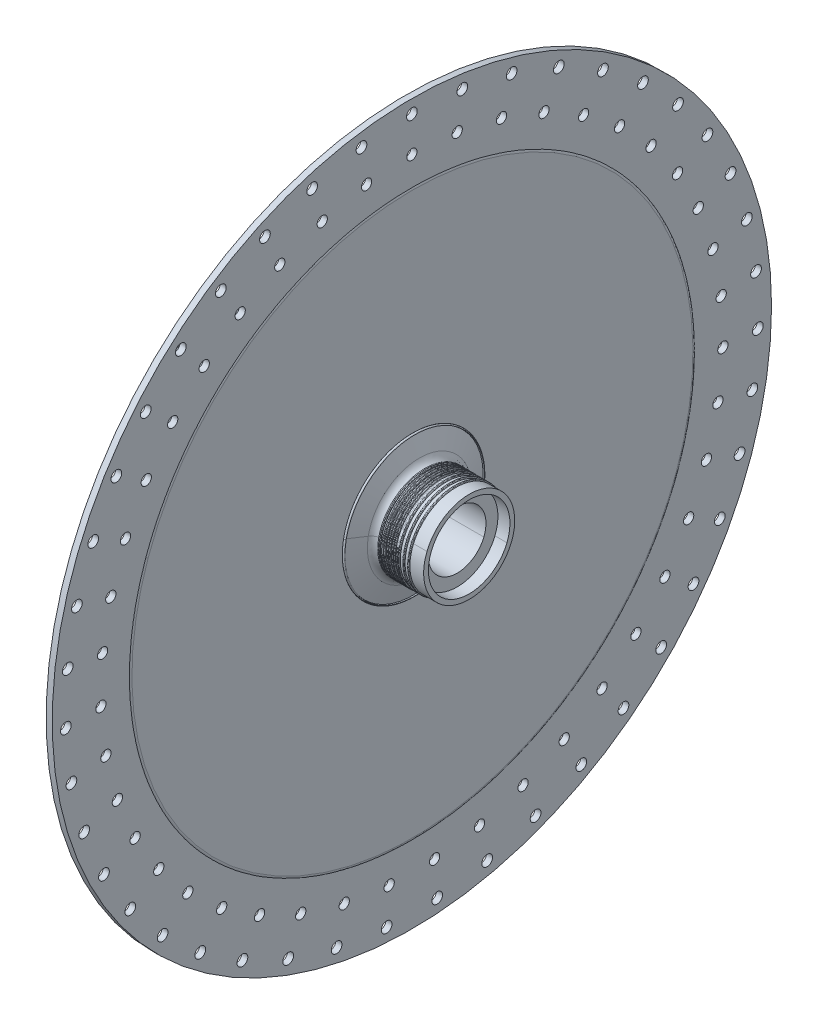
SolidWorks part; units mm, degrees
ref_plane "Alzado" through (0, 0, 0) normal (0, 0, 1) x (1, 0, 0)
ref_plane "Planta" through (0, 0, 0) normal (0, 1, 0) x (1, 0, 0)
ref_plane "Vista lateral" through (0, 0, 0) normal (1, 0, 0) x (0, 0, -1)
imported_body "A1223.IGS<1>"
delete or keep bodies "Sólido-Eliminar/Conservar 1" type delete bodies bodies 106
ref_plane "Plano1" through (70, 0, 0) normal (1, 0, 0) x (0, 0, -1)
sketch "Croquis2" plane through (70, 0, 0) normal (1, 0, 0) x (0, 0, -1)
  circle A0 centre (13.6251, -11.4202) radius 149.987
  dimension "D1" = 299.974
extrude "Saliente-Extruir1" add sketch "Croquis2" against normal blind 2.54
sketch "Croquis3" plane through (70, 0, 0) normal (1, 0, 0) x (0, 0, -1)
  line L0 (13.6251, 132.961) -> (13.6251, 17.5798) construction
  circle A0 centre (13.6251, 132.961) radius 2.235
  arc A1 (42.0967, -16.9313) -> (-14.8464, -5.9092) centre (13.6251, -11.4202) ccw construction
  circle A2 centre (13.6251, 23.0117) radius 1.976
  circle A4 centre (13.6251, 103.5224) radius 2.1431
  circle A5 centre (13.6251, 46.5259) radius 2.2316
  circle A6 centre (13.6251, 59.8166) radius 2.2894
  circle A8 centre (13.6251, 118.3465) radius 2.1431
  circle A9 centre (13.6251, 34.5133) radius 1.9924
  circle A10 centre (13.6251, 75.2704) radius 1.9807
  circle A11 centre (13.6251, 88.6982) radius 2.1195
  circle A12 centre (13.6251, -11.4202) radius 12 construction
  circle A13 centre (30.3609, 102.2975) radius 2.1431
  circle A14 centre (22.0622, 45.9084) radius 2.2316
  circle A15 centre (23.9973, 59.0574) radius 2.2894
  circle A16 centre (32.5193, 116.9637) radius 2.1431
  circle A17 centre (20.3131, 34.0238) radius 1.9924
  circle A18 centre (26.2474, 74.3466) radius 1.9807
  circle A19 centre (28.2025, 87.6312) radius 2.1195
  circle A20 centre (34.6472, 131.4224) radius 2.235
  circle A21 centre (46.74, 98.6489) radius 2.1431
  circle A22 centre (30.3194, 44.0691) radius 2.2316
  circle A23 centre (34.1484, 56.7962) radius 2.2894
  circle A24 centre (51.0108, 112.8445) radius 2.1431
  circle A25 centre (26.8585, 32.5657) radius 1.9924
  circle A26 centre (38.6006, 71.5948) radius 1.9807
  circle A27 centre (42.4692, 84.4532) radius 2.1195
  circle A28 centre (55.2212, 126.8393) radius 2.235
  circle A29 centre (62.4133, 92.6543) radius 2.1431
  circle A30 centre (38.2208, 41.047) radius 2.2316
  circle A31 centre (43.8621, 53.081) radius 2.2894
  circle A32 centre (68.7055, 106.0769) radius 2.1431
  circle A33 centre (33.1219, 30.1702) radius 1.9924
  circle A34 centre (50.4215, 67.0736) radius 1.9807
  circle A35 centre (56.1211, 79.2318) radius 2.1195
  circle A36 centre (74.9087, 119.3095) radius 2.235
  circle A37 centre (77.0467, 84.4416) radius 2.1431
  circle A38 centre (45.598, 36.9068) radius 2.2316
  circle A39 centre (52.9313, 47.9911) radius 2.2894
  circle A40 centre (85.2262, 96.805) radius 2.1431
  circle A41 centre (38.9698, 26.8882) radius 1.9924
  circle A42 centre (61.4582, 60.8796) radius 1.9807
  circle A43 centre (68.8672, 72.0783) radius 2.1195
  circle A44 centre (93.2901, 108.9934) radius 2.235
  circle A45 centre (90.3285, 74.1858) radius 2.1431
  circle A46 centre (52.2937, 31.7365) radius 2.2316
  circle A47 centre (61.1628, 41.635) radius 2.2894
  circle A48 centre (100.2209, 85.2264) radius 2.1431
  circle A49 centre (44.2774, 22.7897) radius 1.9924
  circle A50 centre (71.4754, 53.1445) radius 1.9807
  circle A51 centre (80.436, 63.1452) radius 2.1195
  circle A52 centre (109.9735, 96.1109) radius 2.235
  circle A53 centre (101.9754, 62.1054) radius 2.1431
  circle A54 centre (58.1653, 25.6464) radius 2.2316
  circle A55 centre (68.3811, 34.148) radius 2.2894
  circle A56 centre (113.37, 71.5881) radius 2.1431
  circle A57 centre (48.9318, 17.9622) radius 1.9924
  circle A58 centre (80.2596, 44.0334) radius 1.9807
  circle A59 centre (90.5809, 52.6228) radius 2.1195
  circle A60 centre (124.6034, 80.9366) radius 2.235
  circle A61 centre (111.7393, 48.458) radius 2.1431
  circle A62 centre (63.0876, 18.7663) radius 2.2316
  circle A63 centre (74.4324, 25.6899) radius 2.2894
  circle A64 centre (124.3932, 56.1805) radius 2.1431
  circle A65 centre (52.8336, 12.5084) radius 1.9924
  circle A66 centre (87.6237, 33.7404) radius 1.9807
  circle A67 centre (99.0855, 40.7355) radius 2.1195
  circle A68 centre (136.868, 63.7938) radius 2.235
  circle A69 centre (119.4121, 33.5343) radius 2.1431
  circle A70 centre (66.9557, 11.2428) radius 2.2316
  circle A71 centre (79.1877, 16.4408) radius 2.2894
  circle A72 centre (133.0555, 39.3322) radius 2.1431
  circle A73 centre (55.8998, 6.5446) radius 1.9924
  circle A74 centre (93.4105, 22.4849) radius 1.9807
  circle A75 centre (105.7687, 27.7365) radius 2.1195
  circle A76 centre (146.5059, 45.0479) radius 2.235
  circle A77 centre (124.8302, 17.6526) radius 2.1431
  circle A78 centre (69.6871, 3.2363) radius 2.2316
  circle A79 centre (82.5456, 6.5979) radius 2.2894
  circle A80 centre (139.1724, 21.4021) radius 2.1431
  circle A81 centre (58.065, 0.1979) radius 1.9924
  circle A82 centre (97.4969, 10.5067) radius 1.9807
  circle A83 centre (110.4881, 13.903) radius 2.1195
  circle A84 centre (153.3116, 25.0986) radius 2.235
  circle A85 centre (127.8782, 1.1512) radius 2.1431
  circle A86 centre (71.2237, -5.0826) radius 2.2316
  circle A87 centre (84.4346, -3.629) radius 2.2894
  circle A88 centre (142.6134, 2.7725) radius 2.1431
  circle A89 centre (59.2831, -6.3964) radius 1.9924
  circle A90 centre (99.7957, -1.9388) radius 1.9807
  circle A91 centre (113.1429, -0.4702) radius 2.1195
  circle A92 centre (157.1402, 4.3709) radius 2.235
  circle A93 centre (128.491, -15.6182) radius 2.1431
  circle A94 centre (71.5327, -13.5366) radius 2.2316
  circle A95 centre (84.8144, -14.022) radius 2.2894
  circle A96 centre (143.3053, -16.1596) radius 2.1431
  circle A97 centre (59.528, -13.0978) radius 1.9924
  circle A98 centre (100.2579, -14.5864) radius 1.9807
  circle A99 centre (113.6768, -15.0768) radius 2.1195
  circle A100 centre (157.9101, -16.6933) radius 2.235
  circle A101 centre (126.6557, -32.2981) radius 2.1431
  circle A102 centre (70.6074, -21.9454) radius 2.2316
  circle A103 centre (83.677, -24.3595) radius 2.2894
  circle A104 centre (141.2333, -34.9907) radius 2.1431
  circle A105 centre (58.7946, -19.7635) radius 1.9924
  circle A106 centre (98.8737, -27.1665) radius 1.9807
  circle A107 centre (112.0781, -29.6054) radius 2.1195
  circle A108 centre (155.6047, -37.6452) radius 2.235
  circle A109 centre (122.4114, -48.533) radius 2.1431
  circle A110 centre (68.4677, -30.1299) radius 2.2316
  circle A111 centre (81.0465, -34.4212) radius 2.2894
  circle A112 centre (136.4416, -53.3194) radius 2.1431
  circle A113 centre (57.0984, -26.2513) radius 1.9924
  circle A114 centre (95.6726, -39.411) radius 1.9807
  circle A115 centre (108.3812, -43.7465) radius 2.1195
  circle A116 centre (150.2733, -58.0381) radius 2.235
  circle A117 centre (115.8484, -63.9769) radius 2.1431
  circle A118 centre (65.1591, -37.9157) radius 2.2316
  circle A119 centre (76.979, -43.9927) radius 2.2894
  circle A120 centre (129.0322, -70.7551) radius 2.1431
  circle A121 centre (54.4757, -32.423) radius 1.9924
  circle A122 centre (90.7228, -51.0589) radius 1.9807
  circle A123 centre (102.6647, -57.1986) radius 2.1195
  circle A124 centre (142.0295, -77.4375) radius 2.235
  circle A125 centre (107.1068, -78.3006) radius 2.1431
  circle A126 centre (60.7522, -45.1368) radius 2.2316
  circle A127 centre (71.5613, -52.87) radius 2.2894
  circle A128 centre (119.1631, -86.9262) radius 2.1431
  circle A129 centre (50.9824, -38.1471) radius 1.9924
  circle A130 centre (84.1297, -61.862) radius 1.9807
  circle A131 centre (95.0504, -69.675) radius 2.1195
  circle A132 centre (131.0489, -95.4298) radius 2.235
  circle A133 centre (96.3727, -91.1989) radius 2.1431
  circle A134 centre (55.3408, -51.6392) radius 2.2316
  circle A135 centre (64.9088, -60.8639) radius 2.2894
  circle A136 centre (107.0447, -101.488) radius 2.1431
  circle A137 centre (46.6928, -43.3015) radius 1.9924
  circle A138 centre (76.034, -71.59) radius 1.9807
  circle A139 centre (85.7007, -80.9099) radius 2.1195
  circle A140 centre (117.5657, -111.6316) radius 2.235
  circle A141 centre (83.875, -102.3969) radius 2.1431
  circle A142 centre (49.0403, -57.2845) radius 2.2316
  circle A143 centre (57.1632, -67.804) radius 2.2894
  circle A144 centre (92.9352, -114.1302) radius 2.1431
  circle A145 centre (41.6985, -47.7764) radius 1.9924
  circle A146 centre (66.6082, -80.0356) radius 1.9807
  circle A147 centre (74.8149, -90.6636) radius 2.1195
  circle A148 centre (101.8672, -125.6975) radius 2.235
  circle A149 centre (69.8801, -111.6559) radius 2.1431
  circle A150 centre (41.985, -61.9522) radius 2.2316
  circle A151 centre (48.4897, -73.5423) radius 2.2894
  circle A152 centre (77.1353, -124.5833) radius 2.1431
  circle A153 centre (36.1058, -51.4765) radius 1.9924
  circle A154 centre (56.0531, -87.0188) radius 1.9807
  circle A155 centre (62.6249, -98.7285) radius 2.1195
  circle A156 centre (84.2879, -137.3278) radius 2.235
  circle A157 centre (54.6862, -118.7785) radius 2.1431
  circle A158 centre (34.3253, -65.5429) radius 2.2316
  circle A159 centre (39.0731, -77.9566) radius 2.2894
  circle A160 centre (59.9818, -132.6245) radius 2.1431
  circle A161 centre (30.034, -54.3229) radius 1.9924
  circle A162 centre (44.5937, -92.3907) radius 1.9807
  circle A163 centre (49.3905, -104.9325) radius 2.1195
  circle A164 centre (65.2026, -146.2747) radius 2.235
  circle A165 centre (38.6171, -123.6129) radius 2.1431
  circle A166 centre (26.2244, -67.9801) radius 2.2316
  circle A167 centre (29.1142, -80.9528) radius 2.2894
  circle A168 centre (41.8403, -138.0825) radius 2.1431
  circle A169 centre (23.6125, -56.2548) radius 1.9924
  circle A170 centre (32.4743, -96.0369) radius 1.9807
  circle A171 centre (35.3939, -109.1434) radius 2.1195
  circle A172 centre (45.018, -152.3473) radius 2.235
  circle A173 centre (22.0154, -126.0562) radius 2.1431
  circle A174 centre (17.8549, -69.2119) radius 2.2316
  circle A175 centre (18.8251, -82.467) radius 2.2894
  circle A176 centre (23.0975, -140.8408) radius 2.1431
  circle A177 centre (16.9781, -57.2312) radius 1.9924
  circle A178 centre (19.9531, -97.8796) radius 1.9807
  circle A179 centre (20.9333, -111.2716) radius 2.1195
  circle A180 centre (24.1643, -155.4163) radius 2.235
  circle A181 centre (5.2349, -126.0562) radius 2.1431
  circle A182 centre (9.3953, -69.2119) radius 2.2316
  circle A183 centre (8.4252, -82.467) radius 2.2894
  circle A184 centre (4.1528, -140.8408) radius 2.1431
  circle A185 centre (10.2722, -57.2312) radius 1.9924
  circle A186 centre (7.2971, -97.8796) radius 1.9807
  circle A187 centre (6.317, -111.2716) radius 2.1195
  circle A188 centre (3.086, -155.4163) radius 2.235
  circle A189 centre (-11.3669, -123.6129) radius 2.1431
  circle A190 centre (1.0259, -67.9801) radius 2.2316
  circle A191 centre (-1.8639, -80.9528) radius 2.2894
  circle A192 centre (-14.5901, -138.0825) radius 2.1431
  circle A193 centre (3.6378, -56.2548) radius 1.9924
  circle A194 centre (-5.224, -96.0369) radius 1.9807
  circle A195 centre (-8.1436, -109.1434) radius 2.1195
  circle A196 centre (-17.7677, -152.3473) radius 2.235
  circle A197 centre (-27.4359, -118.7785) radius 2.1431
  circle A198 centre (-7.075, -65.5429) radius 2.2316
  circle A199 centre (-11.8229, -77.9566) radius 2.2894
  circle A200 centre (-32.7316, -132.6245) radius 2.1431
  circle A201 centre (-2.7837, -54.3229) radius 1.9924
  circle A202 centre (-17.3434, -92.3907) radius 1.9807
  circle A203 centre (-22.1403, -104.9325) radius 2.1195
  circle A204 centre (-37.9523, -146.2747) radius 2.235
  circle A205 centre (-42.6298, -111.6559) radius 2.1431
  circle A206 centre (-14.7348, -61.9522) radius 2.2316
  circle A207 centre (-21.2394, -73.5423) radius 2.2894
  circle A208 centre (-49.885, -124.5833) radius 2.1431
  circle A209 centre (-8.8555, -51.4765) radius 1.9924
  circle A210 centre (-28.8028, -87.0188) radius 1.9807
  circle A211 centre (-35.3746, -98.7285) radius 2.1195
  circle A212 centre (-57.0376, -137.3278) radius 2.235
  circle A213 centre (-56.6248, -102.3969) radius 2.1431
  circle A214 centre (-21.7901, -57.2845) radius 2.2316
  circle A215 centre (-29.913, -67.804) radius 2.2894
  circle A216 centre (-65.6849, -114.1302) radius 2.1431
  circle A217 centre (-14.4482, -47.7764) radius 1.9924
  circle A218 centre (-39.3579, -80.0356) radius 1.9807
  circle A219 centre (-47.5646, -90.6636) radius 2.1195
  circle A220 centre (-74.6169, -125.6975) radius 2.235
  circle A221 centre (-69.1224, -91.1989) radius 2.1431
  circle A222 centre (-28.0905, -51.6392) radius 2.2316
  circle A223 centre (-37.6585, -60.8639) radius 2.2894
  circle A224 centre (-79.7944, -101.488) radius 2.1431
  circle A225 centre (-19.4426, -43.3015) radius 1.9924
  circle A226 centre (-48.7838, -71.59) radius 1.9807
  circle A227 centre (-58.4505, -80.9099) radius 2.1195
  circle A228 centre (-90.3154, -111.6316) radius 2.235
  circle A229 centre (-79.8565, -78.3006) radius 2.1431
  circle A230 centre (-33.5019, -45.1368) radius 2.2316
  circle A231 centre (-44.3111, -52.87) radius 2.2894
  circle A232 centre (-91.9129, -86.9262) radius 2.1431
  circle A233 centre (-23.7321, -38.1471) radius 1.9924
  circle A234 centre (-56.8795, -61.862) radius 1.9807
  circle A235 centre (-67.8002, -69.675) radius 2.1195
  circle A236 centre (-103.7987, -95.4298) radius 2.235
  circle A237 centre (-88.5982, -63.9769) radius 2.1431
  circle A238 centre (-37.9089, -37.9157) radius 2.2316
  circle A239 centre (-49.7288, -43.9927) radius 2.2894
  circle A240 centre (-101.7819, -70.7551) radius 2.1431
  circle A241 centre (-27.2255, -32.423) radius 1.9924
  circle A242 centre (-63.4725, -51.0589) radius 1.9807
  circle A243 centre (-75.4144, -57.1986) radius 2.1195
  circle A244 centre (-114.7792, -77.4375) radius 2.235
  circle A245 centre (-95.1611, -48.533) radius 2.1431
  circle A246 centre (-41.2175, -30.1299) radius 2.2316
  circle A247 centre (-53.7962, -34.4212) radius 2.2894
  circle A248 centre (-109.1913, -53.3194) radius 2.1431
  circle A249 centre (-29.8482, -26.2513) radius 1.9924
  circle A250 centre (-68.4223, -39.411) radius 1.9807
  circle A251 centre (-81.1309, -43.7465) radius 2.1195
  circle A252 centre (-123.023, -58.0381) radius 2.235
  circle A253 centre (-99.4055, -32.2981) radius 2.1431
  circle A254 centre (-43.3572, -21.9454) radius 2.2316
  circle A255 centre (-56.4267, -24.3595) radius 2.2894
  circle A256 centre (-113.9831, -34.9907) radius 2.1431
  circle A257 centre (-31.5443, -19.7635) radius 1.9924
  circle A258 centre (-71.6235, -27.1665) radius 1.9807
  circle A259 centre (-84.8279, -29.6054) radius 2.1195
  circle A260 centre (-128.3544, -37.6452) radius 2.235
  circle A261 centre (-101.2408, -15.6182) radius 2.1431
  circle A262 centre (-44.2824, -13.5366) radius 2.2316
  circle A263 centre (-57.5642, -14.022) radius 2.2894
  circle A264 centre (-116.0551, -16.1596) radius 2.1431
  circle A265 centre (-32.2777, -13.0978) radius 1.9924
  circle A266 centre (-73.0077, -14.5864) radius 1.9807
  circle A267 centre (-86.4265, -15.0768) radius 2.1195
  circle A268 centre (-130.6598, -16.6933) radius 2.235
  circle A269 centre (-100.6279, 1.1512) radius 2.1431
  circle A270 centre (-43.9734, -5.0826) radius 2.2316
  circle A271 centre (-57.1844, -3.629) radius 2.2894
  circle A272 centre (-115.3632, 2.7725) radius 2.1431
  circle A273 centre (-32.0328, -6.3964) radius 1.9924
  circle A274 centre (-72.5454, -1.9388) radius 1.9807
  circle A275 centre (-85.8927, -0.4702) radius 2.1195
  circle A276 centre (-129.89, 4.3709) radius 2.235
  circle A277 centre (-97.58, 17.6526) radius 2.1431
  circle A278 centre (-42.4369, 3.2363) radius 2.2316
  circle A279 centre (-55.2953, 6.5979) radius 2.2894
  circle A280 centre (-111.9221, 21.4021) radius 2.1431
  circle A281 centre (-30.8148, 0.1979) radius 1.9924
  circle A282 centre (-70.2466, 10.5067) radius 1.9807
  circle A283 centre (-83.2378, 13.903) radius 2.1195
  circle A284 centre (-126.0614, 25.0986) radius 2.235
  circle A285 centre (-92.1619, 33.5343) radius 2.1431
  circle A286 centre (-39.7054, 11.2428) radius 2.2316
  circle A287 centre (-51.9374, 16.4408) radius 2.2894
  circle A288 centre (-105.8052, 39.3322) radius 2.1431
  circle A289 centre (-28.6496, 6.5446) radius 1.9924
  circle A290 centre (-66.1603, 22.4849) radius 1.9807
  circle A291 centre (-78.5185, 27.7365) radius 2.1195
  circle A292 centre (-119.2556, 45.0479) radius 2.235
  circle A293 centre (-84.4891, 48.458) radius 2.1431
  circle A294 centre (-35.8373, 18.7663) radius 2.2316
  circle A295 centre (-47.1821, 25.6899) radius 2.2894
  circle A296 centre (-97.1429, 56.1805) radius 2.1431
  circle A297 centre (-25.5834, 12.5084) radius 1.9924
  circle A298 centre (-60.3734, 33.7404) radius 1.9807
  circle A299 centre (-71.8353, 40.7355) radius 2.1195
  circle A300 centre (-109.6177, 63.7938) radius 2.235
  circle A301 centre (-74.7252, 62.1054) radius 2.1431
  circle A302 centre (-30.915, 25.6464) radius 2.2316
  circle A303 centre (-41.1309, 34.148) radius 2.2894
  circle A304 centre (-86.1197, 71.5881) radius 2.1431
  circle A305 centre (-21.6815, 17.9622) radius 1.9924
  circle A306 centre (-53.0094, 44.0334) radius 1.9807
  circle A307 centre (-63.3306, 52.6228) radius 2.1195
  circle A308 centre (-97.3531, 80.9366) radius 2.235
  circle A309 centre (-63.0782, 74.1858) radius 2.1431
  circle A310 centre (-25.0435, 31.7365) radius 2.2316
  circle A311 centre (-33.9126, 41.635) radius 2.2894
  circle A312 centre (-72.9707, 85.2264) radius 2.1431
  circle A313 centre (-17.0272, 22.7897) radius 1.9924
  circle A314 centre (-44.2252, 53.1445) radius 1.9807
  circle A315 centre (-53.1858, 63.1452) radius 2.1195
  circle A316 centre (-82.7232, 96.1109) radius 2.235
  circle A317 centre (-49.7965, 84.4416) radius 2.1431
  circle A318 centre (-18.3477, 36.9068) radius 2.2316
  circle A319 centre (-25.6811, 47.9911) radius 2.2894
  circle A320 centre (-57.976, 96.805) radius 2.1431
  circle A321 centre (-11.7195, 26.8882) radius 1.9924
  circle A322 centre (-34.208, 60.8796) radius 1.9807
  circle A323 centre (-41.617, 72.0783) radius 2.1195
  circle A324 centre (-66.0398, 108.9934) radius 2.235
  circle A325 centre (-35.163, 92.6543) radius 2.1431
  circle A326 centre (-10.9705, 41.047) radius 2.2316
  circle A327 centre (-16.6118, 53.081) radius 2.2894
  circle A328 centre (-41.4552, 106.0769) radius 2.1431
  circle A329 centre (-5.8717, 30.1702) radius 1.9924
  circle A330 centre (-23.1713, 67.0736) radius 1.9807
  circle A331 centre (-28.8708, 79.2318) radius 2.1195
  circle A332 centre (-47.6585, 119.3095) radius 2.235
  circle A333 centre (-19.4897, 98.6489) radius 2.1431
  circle A334 centre (-3.0691, 44.0691) radius 2.2316
  circle A335 centre (-6.8981, 56.7962) radius 2.2894
  circle A336 centre (-23.7606, 112.8445) radius 2.1431
  circle A337 centre (0.3917, 32.5657) radius 1.9924
  circle A338 centre (-11.3504, 71.5948) radius 1.9807
  circle A339 centre (-15.2189, 84.4532) radius 2.1195
  circle A340 centre (-27.971, 126.8393) radius 2.235
  circle A341 centre (-3.1106, 102.2975) radius 2.1431
  circle A342 centre (5.1881, 45.9084) radius 2.2316
  circle A343 centre (3.253, 59.0574) radius 2.2894
  circle A344 centre (-5.2691, 116.9637) radius 2.1431
  circle A345 centre (6.9372, 34.0238) radius 1.9924
  circle A346 centre (1.0029, 74.3466) radius 1.9807
  circle A347 centre (-0.9522, 87.6312) radius 2.1195
  circle A348 centre (-7.397, 131.4224) radius 2.235
  circle A349 centre (19.952, 22.4255) radius 1.976
  circle A350 centre (26.0634, 20.6866) radius 1.976
  circle A351 centre (31.7512, 17.8544) radius 1.976
  circle A352 centre (36.8218, 14.0253) radius 1.976
  circle A353 centre (41.1024, 9.3297) radius 1.976
  circle A354 centre (44.4474, 3.9274) radius 1.976
  circle A355 centre (46.7427, -1.9975) radius 1.976
  circle A356 centre (47.9102, -8.2433) radius 1.976
  circle A357 centre (47.9102, -14.5972) radius 1.976
  circle A358 centre (46.7427, -20.843) radius 1.976
  circle A359 centre (44.4474, -26.7679) radius 1.976
  circle A360 centre (41.1024, -32.1702) radius 1.976
  circle A361 centre (36.8218, -36.8658) radius 1.976
  circle A362 centre (31.7512, -40.6949) radius 1.976
  circle A363 centre (26.0634, -43.5271) radius 1.976
  circle A364 centre (19.952, -45.266) radius 1.976
  circle A365 centre (13.6251, -45.8522) radius 1.976
  circle A366 centre (7.2983, -45.266) radius 1.976
  circle A367 centre (1.1869, -43.5271) radius 1.976
  circle A368 centre (-4.501, -40.6949) radius 1.976
  circle A369 centre (-9.5715, -36.8658) radius 1.976
  circle A370 centre (-13.8522, -32.1702) radius 1.976
  circle A371 centre (-17.1971, -26.7679) radius 1.976
  circle A372 centre (-19.4924, -20.843) radius 1.976
  circle A373 centre (-20.66, -14.5972) radius 1.976
  circle A374 centre (-20.66, -8.2433) radius 1.976
  circle A375 centre (-19.4924, -1.9975) radius 1.976
  circle A376 centre (-17.1971, 3.9274) radius 1.976
  circle A377 centre (-13.8522, 9.3297) radius 1.976
  circle A378 centre (-9.5715, 14.0253) radius 1.976
  circle A379 centre (-4.501, 17.8544) radius 1.976
  circle A380 centre (1.1869, 20.6866) radius 1.976
  circle A381 centre (7.2983, 22.4255) radius 1.976
  point P700 (13.6251, -11.4202)
  point P767 (13.6251, -11.4202)
  dimension "D1" = 43
  dimension "D2" = 34
extrude "Cortar-Extruir1" cut sketch "Croquis3" against normal blind 2.54
